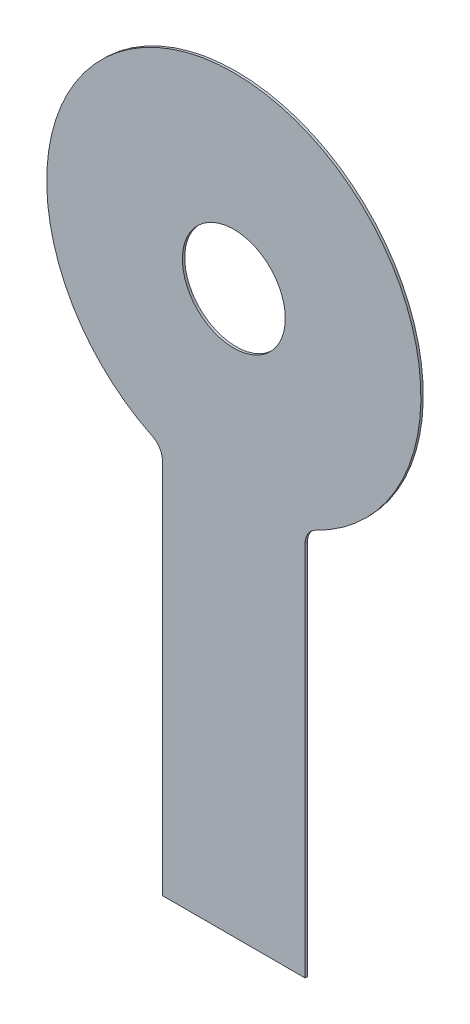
SolidWorks part; units mm, degrees
ref_plane "Front Plane" through (0, 0, 0) normal (0, 0, 1) x (1, 0, 0)
ref_plane "Top Plane" through (0, 0, 0) normal (0, 1, 0) x (1, 0, 0)
ref_plane "Right Plane" through (0, 0, 0) normal (1, 0, 0) x (0, 0, -1)
sketch "Sketch1" plane through (0, 0, 0) normal (0, 0, 1) x (1, 0, 0)
  line L670 (-3.81, -9.8926) -> (-3.81, -29.9998)
  line L671 (-3.81, -29.9998) -> (3.81, -29.9998)
  line L672 (3.81, -29.9998) -> (3.81, -9.8926)
  circle A258 centre (0, 0) radius 2.75
  arc A259 (4.3727, -8.9933) -> (3.81, -9.8926) centre (4.81, -9.8926) ccw
  arc A260 (4.3727, -8.9933) -> (-4.3727, -8.9933) centre (0, 0) ccw
  arc A261 (-3.81, -9.8926) -> (-4.3727, -8.9933) centre (-4.81, -9.8926) ccw
extrude "Boss-Extrude1" add sketch "Sketch1" along normal blind 0.127
